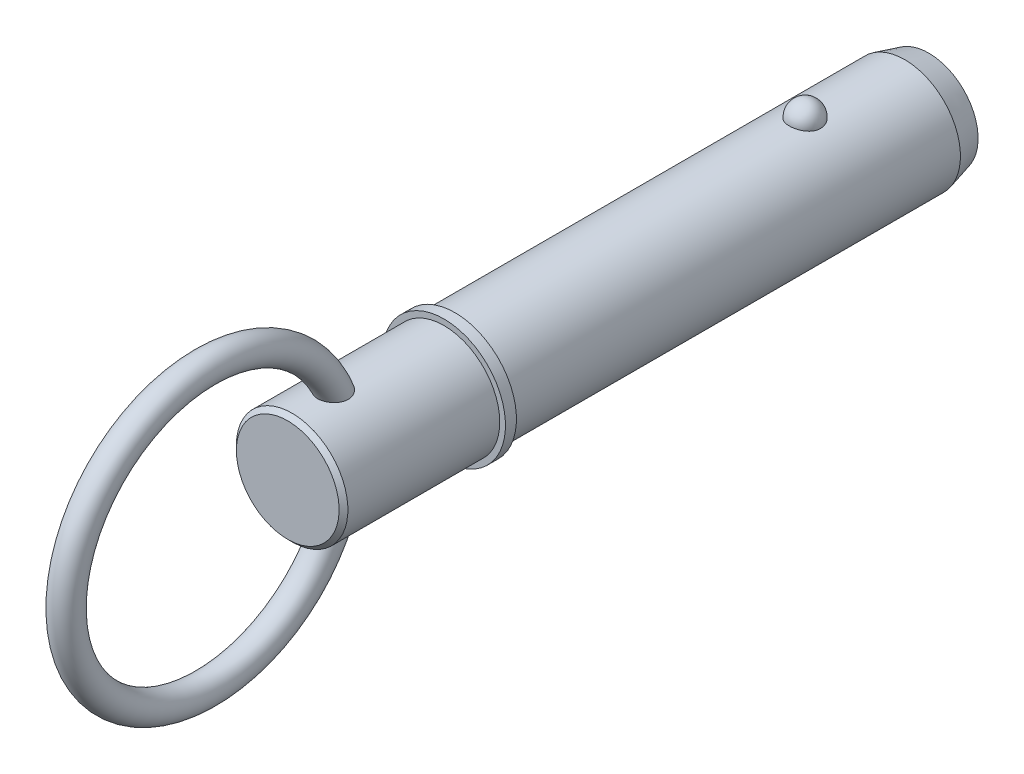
SolidWorks part; units mm, degrees
ref_plane "Front Plane" through (0, 0, 0) normal (0, 0, 1) x (1, 0, 0)
ref_plane "Top Plane" through (0, 0, 0) normal (0, 1, 0) x (1, 0, 0)
ref_plane "Right Plane" through (0, 0, 0) normal (1, 0, 0) x (0, 0, -1)
sketch "Sketch2" plane through (0, 0, 0) normal (0, 0, 1) x (1, 0, 0)
  circle A0 centre (0, 0) radius 12.7
  point P3 (0, 12.7)
  dimension "D1" = 25.4
extrude "Boss-Extrude1" add sketch "Sketch2" along normal blind 76.2
sketch "Sketch3" plane through (0, 0, 0) normal (0, 0, -1) x (-1, 0, 0)
  circle A0 centre (0, 0) radius 12.7
  dimension "D1" = 25.4
extrude "Boss-Extrude2" add sketch "Sketch3" along normal blind 31.75
chamfer "Chamfer1" distance 5.5 angle 15 1 edges at (-12.7, 0, -31.75)
sketch "Sketch18" plane through (0, 0, 0) normal (1, 0, 0) x (0, 0, -1)
  line L0 (26.25, 12.7) -> (-76.2, 12.7) construction
  line L1 (3.56, 16.26) -> (3.56, 9.14)
  line L2 (-76.2, -12.7) -> (26.25, -12.7) construction
  arc A0 (3.56, 16.26) -> (3.56, 9.14) centre (3.56, 12.7) ccw
  point P4 (0, 12.7)
  dimension "D1" = 28.96
revolve "Revolve1" add sketch "Sketch18" angle 360 about L1
sketch "Sketch19" plane through (0, 0, 0) normal (1, 0, 0) x (0, 0, -1)
  line L0 (-33.7288, 0) -> (-46.4542, 0) construction
sketch "Sketch20" plane through (0, 0, 0) normal (1, 0, 0) x (0, 0, -1)
  line L0 (-76.2, 0) -> (-76.2, 14)
  line L1 (-76.2, 12.7) -> (-76.2, -12.7) construction
  line L2 (-76.2, 14) -> (-78.7, 14)
  line L3 (-78.7, 14) -> (-78.7, 0)
  line L4 (-33.7288, 0) -> (-46.4542, 0) construction
  line L5 (-78.7, 0) -> (-76.2, 0)
  dimension "D1" = 14
  dimension "D2" = 2.5
revolve "Revolve2" add sketch "Sketch20" angle 360 about L0
sketch "Sketch21" plane through (0, 0, 76.2) normal (0, 0, -1) x (-1, 0, 0)
  circle A0 centre (0, 0) radius 12.7
  dimension "D1" = 25.4
extrude "Boss-Extrude3" add sketch "Sketch21" against normal blind 38.1
chamfer "Chamfer2" distance 1 angle 45 1 edges at (-12.7, 0, 114.3)
sketch "Sketch23" plane through (0, 0, 0) normal (1, 0, 0) x (0, 0, -1)
  line L0 (-114.3, 11.7) -> (-114.3, -11.7) construction
  circle A0 centre (-133.05, 0) radius 31.75
  point P2 (-101.3, 0)
  dimension "D1" = 63.5
  dimension "D2" = 13
sketch "Sketch24" plane through (0, 0, 0) normal (0, 1, 0) x (1, 0, 0)
  circle A0 centre (0, -101.3) radius 3.25
  dimension "D1" = 6.5
sweep "Sweep1" add profiles "Sketch24" path "Sketch23"
